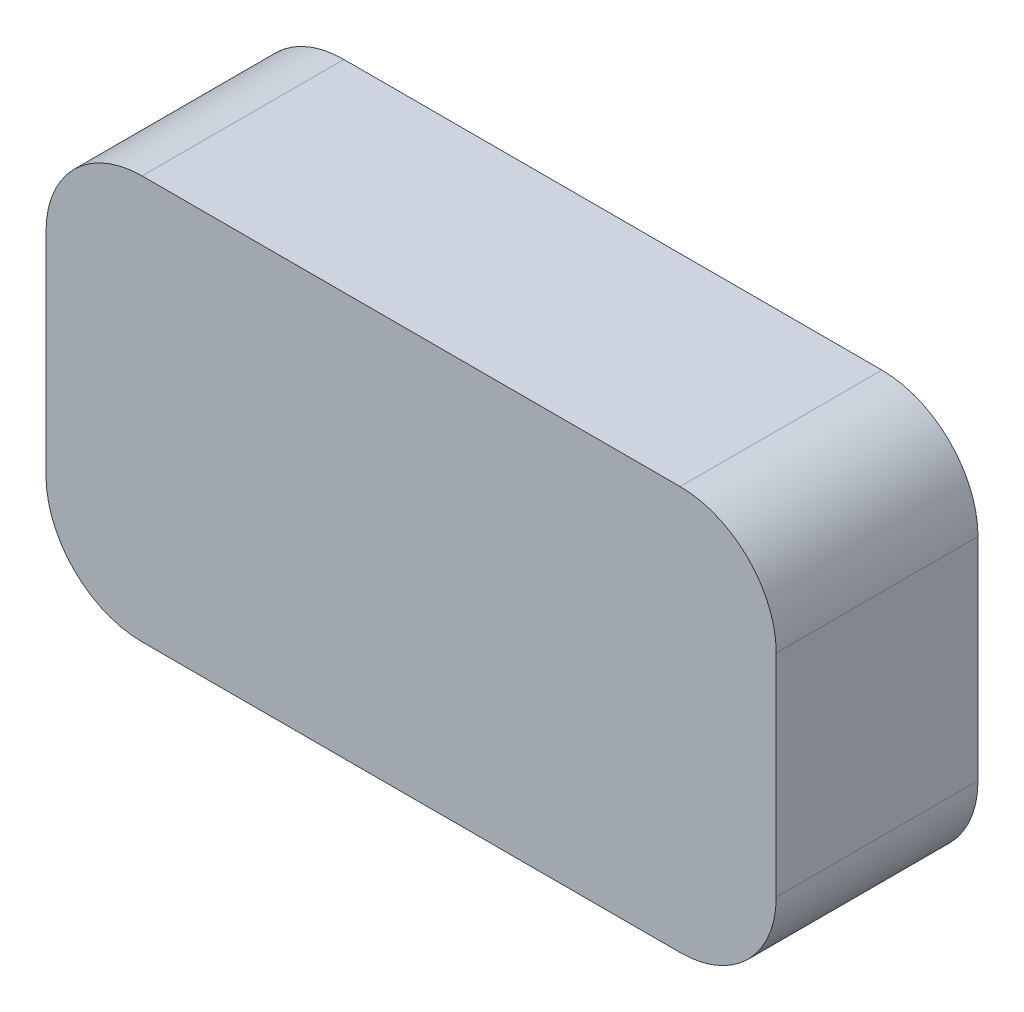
SolidWorks part; units mm, degrees
ref_plane "Front Plane" through (0, 0, 0) normal (0, 0, 1) x (1, 0, 0)
ref_plane "Top Plane" through (0, 0, 0) normal (0, 1, 0) x (1, 0, 0)
ref_plane "Right Plane" through (0, 0, 0) normal (1, 0, 0) x (0, 0, -1)
sketch "Sketch1" plane through (0, 0, 0) normal (0, 0, 1) x (1, 0, 0)
  line L7 (140, 115) -> (-140, 115)
  line L8 (190, -45) -> (190, 65)
  line L10 (-190, 65) -> (-190, -45)
  line L29 (-140, -95) -> (140, -95)
  arc A13 (140, -95) -> (190, -45) centre (140, -45) ccw
  arc A15 (190, 65) -> (140, 115) centre (140, 65) ccw
  arc A17 (-140, 115) -> (-190, 65) centre (-140, 65) ccw
  arc A19 (-190, -45) -> (-140, -95) centre (-140, -45) ccw
extrude "Boss-Extrude1" add sketch "Sketch1" along normal blind 3
sketch "Sketch2" plane through (0, 0, 3) normal (0, 0, 1) x (1, 0, 0)
  line L5 (140, 113) -> (-140, 113)
  line L6 (-188, 65) -> (-188, -45)
  line L7 (-140, -93) -> (140, -93)
  line L12 (188, -45) -> (188, 65)
  line L13 (140, 115) -> (-140, 115)
  line L14 (-190, 65) -> (-190, -45)
  line L15 (-140, -95) -> (140, -95)
  line L16 (190, -45) -> (190, 65)
  line L17 (140, 115) -> (-140, 115)
  line L18 (-190, 65) -> (-190, -45)
  line L19 (-140, -95) -> (140, -95)
  line L20 (190, -45) -> (190, 65)
  arc A4 (-140, 113) -> (-188, 65) centre (-140, 65) ccw
  arc A5 (-188, -45) -> (-140, -93) centre (-140, -45) ccw
  arc A6 (140, -93) -> (188, -45) centre (140, -45) ccw
  arc A7 (188, 65) -> (140, 113) centre (140, 65) ccw
  arc A16 (190, 65) -> (140, 115) centre (140, 65) ccw
  arc A17 (-140, 115) -> (-190, 65) centre (-140, 65) ccw
  arc A18 (-190, -45) -> (-140, -95) centre (-140, -45) ccw
  arc A19 (140, -95) -> (190, -45) centre (140, -45) ccw
  arc A24 (190, 65) -> (140, 115) centre (140, 65) ccw
  arc A25 (-140, 115) -> (-190, 65) centre (-140, 65) ccw
  arc A26 (-190, -45) -> (-140, -95) centre (-140, -45) ccw
  arc A27 (140, -95) -> (190, -45) centre (140, -45) ccw
  dimension "D1" = 0
  dimension "D2" = 2
extrude "Boss-Extrude2" add sketch "Sketch2" along normal blind 100
sketch "Sketch3" plane through (0, 0, 103) normal (0, 0, 1) x (1, 0, 0)
  line L4 (140, 115) -> (-140, 115)
  line L5 (-190, 65) -> (-190, -45)
  line L6 (-140, -95) -> (140, -95)
  line L7 (190, -45) -> (190, 65)
  line L8 (140, 115) -> (-140, 115)
  line L9 (-190, 65) -> (-190, -45)
  line L10 (-140, -95) -> (140, -95)
  line L11 (190, -45) -> (190, 65)
  arc A4 (190, 65) -> (140, 115) centre (140, 65) ccw
  arc A5 (-140, 115) -> (-190, 65) centre (-140, 65) ccw
  arc A6 (-190, -45) -> (-140, -95) centre (-140, -45) ccw
  arc A7 (140, -95) -> (190, -45) centre (140, -45) ccw
  arc A8 (190, 65) -> (140, 115) centre (140, 65) ccw
  arc A9 (-140, 115) -> (-190, 65) centre (-140, 65) ccw
  arc A10 (-190, -45) -> (-140, -95) centre (-140, -45) ccw
  arc A11 (140, -95) -> (190, -45) centre (140, -45) ccw
  dimension "D1" = 0
extrude "Boss-Extrude3" add sketch "Sketch3" along normal blind 2
